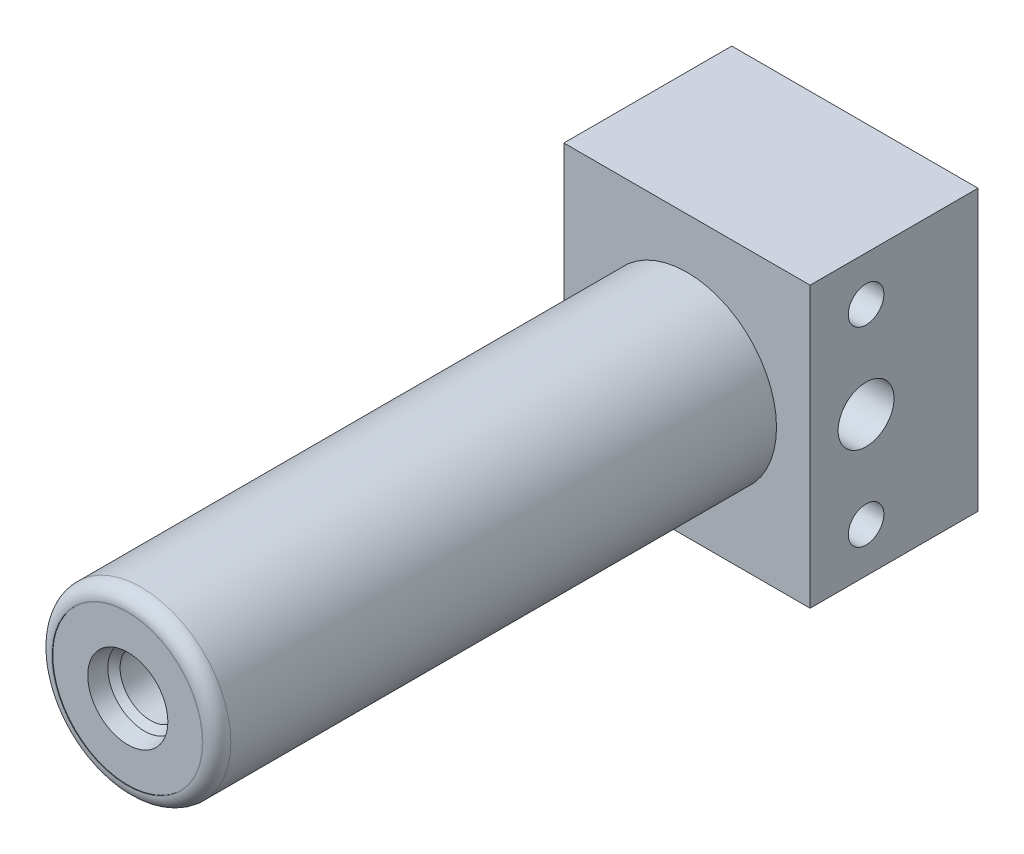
SolidWorks part; units mm, degrees
ref_plane "Front Plane" through (0, 0, 0) normal (0, 0, 1) x (1, 0, 0)
ref_plane "Top Plane" through (0, 0, 0) normal (0, 1, 0) x (1, 0, 0)
ref_plane "Right Plane" through (0, 0, 0) normal (1, 0, 0) x (0, 0, -1)
sketch "Sketch1" plane through (0, 0, 0) normal (0, 0, 1) x (1, 0, 0)
  line L0 (0, 0) -> (0, 15.875) construction
  line L1 (0, 0) -> (13.97, 0) construction
  line L2 (-13.97, 15.875) -> (13.97, 15.875)
  line L3 (13.97, 15.875) -> (13.97, -15.875)
  line L4 (-13.97, 15.875) -> (-13.97, -15.875)
  line L5 (-13.97, -15.875) -> (13.97, -15.875)
  point P9 (-13.97, 0)
  dimension "D1" = 15.875
  dimension "D2" = 13.97
extrude "base" add sketch "Sketch1" along normal blind 19.05
sketch "Sketch2" plane through (0, 0, 19.05) normal (0, 0, 1) x (1, 0, 0)
  circle A0 centre (0, 0) radius 10.16
  dimension "D1" = 20.32
extrude "cylinder" add sketch "Sketch2" along normal offset from surface (63.5 mm away) 82.55
sketch "Sketch3" plane through (0, 0, 0) normal (0, 0, -1) x (-1, 0, 0)
  circle A0 centre (0, 0) radius 5.715
  dimension "D1" = 11.43
extrude "bore" cut sketch "Sketch3" against normal blind 60.96
sketch "Sketch4" plane through (0, 0, 0) normal (0, 0, -1) x (-1, 0, 0)
  circle A0 centre (0, 0) radius 7.1374
  dimension "D1" = 14.2748
extrude "oring_bore" cut sketch "Sketch4" against normal blind 8.128
sketch "Sketch5" plane through (0, 0, 0) normal (0, 0, 1) x (1, 0, 0)
  line L0 (0, 0) -> (13.97, 0) construction
  line L1 (13.97, -15.875) -> (13.97, 15.875) construction
  line L2 (0, 0) -> (8.9803, 8.9803) construction
  circle A0 centre (0, 0) radius 12.7 construction
  circle A1 centre (8.9803, 8.9803) radius 2.0193
  circle A2 centre (8.9803, -8.9803) radius 2.0193
  circle A3 centre (-8.9803, -8.9803) radius 2.0193
  circle A4 centre (-8.9803, 8.9803) radius 2.0193
  dimension "D2" = 25.4
  dimension "D3" = 4.0386
  dimension "D1" = 45
sketch "Sketch6" plane through (-13.97, 0, 0) normal (-1, 0, 0) x (0, 0, 1)
  circle A0 centre (66.04, 0) radius 2.3813
  dimension "D1" = 4.7625
  dimension "D2" = 66.04
extrude "side_port" cut sketch "Sketch6" against normal blind 15.24
sketch "Sketch7" plane through (-13.97, 0, 0) normal (-1, 0, 0) x (0, 0, 1)
  circle A0 centre (66.04, 0) radius 3.175
  circle A1 centre (66.04, 0) radius 2.3812 construction
  dimension "D1" = 6.35
extrude "side_weld" cut sketch "Sketch7" against normal blind 7.62
sketch "Sketch8" plane through (0, 0, 60.96) normal (0, 0, -1) x (-1, 0, 0)
  circle A0 centre (0, 0) radius 3.175
  dimension "D1" = 6.35
extrude "center_hole" cut sketch "Sketch8" against normal blind 8.89
fillet "Fillet1" radius 1.5875 1 edges at (10.16, 0, 82.55)
sketch "Sketch21" plane through (3.8084, 0.224, 82.55) normal (0, 0, 1) x (1, 0, 0)
  circle A0 centre (-3.8084, -0.224) radius 3.4544
  dimension "D1" = 6.9088
extrude "thru_hole" cut sketch "Sketch21" against normal blind 25.4
sketch "Sketch31" plane through (0, 0, 82.55) normal (0, 0, 1) x (1, 0, 0)
  circle A0 centre (0, 0) radius 8.509
  dimension "D1" = 17.018
extrude "land" cut sketch "Sketch31" against normal blind 0.0508
sketch "Sketch41" plane through (0, 0, 82.4992) normal (0, 0, 1) x (1, 0, 0)
  circle A0 centre (0, 0) radius 4.5466
  dimension "D1" = 9.0932
extrude "12_deg_chamfer" cut sketch "Sketch41" against normal blind 1.8796 draft 12
sketch "Sketch51" plane through (0, 0, 80.6196) normal (0, 0, 1) x (1, 0, 0)
  circle A0 centre (0, 0) radius 4.1529
  dimension "D1" = 8.3058
extrude "45_deg_chamfer" cut sketch "Sketch51" against normal blind 2.54 draft 45
other "boss_7161"
chamfer "Chamfer1" distance 1.016 angle 15 1 edges at (-7.1374, 0, 0)
sketch "Sketch53" plane through (13.97, 0, 0) normal (1, 0, 0) x (0, 0, -1)
  line L0 (-66.04, 0) -> (-12.7, 0) construction
  circle A0 centre (-12.7, 0) radius 2.3813
  dimension "D2" = 4.7625
  dimension "D1" = 53.34
extrude "upper_side_port" cut sketch "Sketch53" against normal blind 15.24
sketch "Sketch54" plane through (13.97, 0, 0) normal (1, 0, 0) x (0, 0, -1)
  circle A0 centre (-12.7, 0) radius 3.175
  dimension "D1" = 6.35
extrude "upper_side_well" cut sketch "Sketch54" against normal blind 7.62
hole_wizard "#10-32 Tapped Hole2" positions "Sketch58" profile "Sketch57" tap size "#10-32" standard "Ansi Inch"
sketch "Sketch58" plane through (0, 0, 0) normal (0, 0, -1) x (-1, 0, 0)
  point P1 (8.9803, 8.9803)
  point P4 (8.9803, -8.9803)
  point P7 (-8.9803, -8.9803)
  point P10 (-8.9803, 8.9803)
sketch "Sketch57" plane through (-8.9803, 8.9803, 0) normal (1, 0, 0) x (0, 1, 0)
  line L0 (0, 0) -> (0, 7.5633)
  line L1 (0, 7.5633) -> (2.0193, 6.35)
  line L2 (2.0193, 6.35) -> (2.0193, 0)
  line L5 (2.0193, 0) -> (0, 0)
  line L10 (0, 7.5633) -> (-2.0193, 6.35) construction
  line L11 (0, -6.35) -> (0, 107.95) construction
  dimension "Tap Drill Dia." = 4.0386
  dimension "Tap Drill Depth" = 6.35
  dimension "Drill Angle" = 118
hole_wizard "#10-32 Tapped Hole3" positions "Sketch63" profile "Sketch62" tap size "#10-32" standard "Ansi Inch"
sketch "Sketch63" plane through (13.97, 0, 0) normal (1, 0, 0) x (0, 0, -1)
  line L2 (-12.7, 5.7531) -> (-12.7, -5.7531) construction
  line L3 (-12.7, -5.7531) -> (-12.7, -10.814) construction
  line L4 (-12.7, -10.814) -> (-12.7, -15.875) construction
  line L5 (-19.05, -15.875) -> (0, -15.875) construction
  line L8 (-12.7, 5.7531) -> (-12.7, 10.814) construction
  line L9 (-12.7, 10.814) -> (-12.7, 15.875) construction
  line L10 (-19.05, 15.875) -> (0, 15.875) construction
  line L13 (0, -15.875) -> (0, 15.875) construction
  point P0 (-12.7, 10.814)
  point P39 (-12.7, -10.814)
  dimension "D1" = 12.7
  dimension "D2" = 11.5062
sketch "Sketch62" plane through (13.97, 10.814, 12.7) normal (0, 1, 0) x (0, 0, -1)
  line L0 (0, 0) -> (0, 13.9133)
  line L1 (0, 13.9133) -> (2.0193, 12.7)
  line L2 (2.0193, 12.7) -> (2.0193, 0)
  line L5 (2.0193, 0) -> (0, 0)
  line L10 (0, 13.9133) -> (-2.0193, 12.7) construction
  line L11 (0, -6.35) -> (0, 107.95) construction
  dimension "Tap Drill Dia." = 4.0386
  dimension "Tap Drill Depth" = 12.7
  dimension "Drill Angle" = 118
